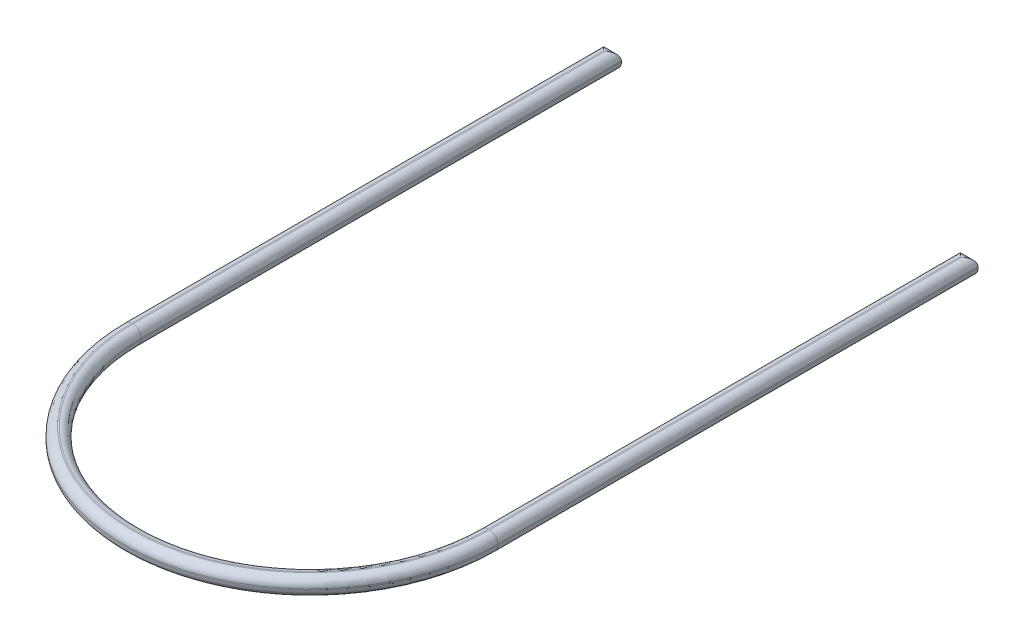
SolidWorks part; units mm, degrees
ref_plane "Front Plane" through (0, 0, 0) normal (0, 0, 1) x (1, 0, 0)
ref_plane "Top Plane" through (0, 0, 0) normal (0, 1, 0) x (1, 0, 0)
ref_plane "Right Plane" through (0, 0, 0) normal (1, 0, 0) x (0, 0, -1)
sketch "Sketch1" plane through (0, 0, 0) normal (0, 1, 0) x (1, 0, 0)
  line L0 (-84.1375, 0) -> (-84.1375, 215.9)
  line L1 (-84.1375, 215.9) -> (-76.2, 215.9)
  line L2 (84.1375, 0) -> (84.1375, 215.9)
  line L3 (84.1375, 215.9) -> (76.2, 215.9)
  line L4 (76.2, 215.9) -> (76.2, 0)
  line L5 (-76.2, 215.9) -> (-76.2, 0)
  arc A0 (-76.2, 0) -> (76.2, 0) centre (0, 0) ccw
  arc A1 (-84.1375, 0) -> (84.1375, 0) centre (0, 0) ccw
  circle A3 centre (0, 0) radius 76.2 construction
  circle A4 centre (0, 0) radius 84.1375 construction
  point P1 (85.725, 0)
  point P10 (72.8704, 22.2787)
  dimension "D1" = 152.4
  dimension "D3" = 215.9
  dimension "D4" = 7.9375
  dimension "D5" = 7.9375
  dimension "D2" = 7.9375
extrude "Boss-Extrude1" add sketch "Sketch1" against normal blind 7.9375
fillet "Fillet1" radius 3.683 14 edges at (-84.1375, 0, -107.95) (-80.1688, 0, -215.9) (-76.2, 0, -107.95) (0, 0, 76.2) (76.2, 0, -107.95) (80.1688, 0, -215.9) (84.1375, 0, -107.95) (0, 0, 84.1375) (76.2, -7.9375, -107.95) (-76.2, -7.9375, -107.95) (0, -7.9375, 76.2) (84.1375, -7.9375, -107.95) (0, -7.9375, 84.1375) (-84.1375, -7.9375, -107.95)
equation "\"Buoyancy\"= \"SW-Volume\" * ( \"SW-Density\" - .037062 )"
